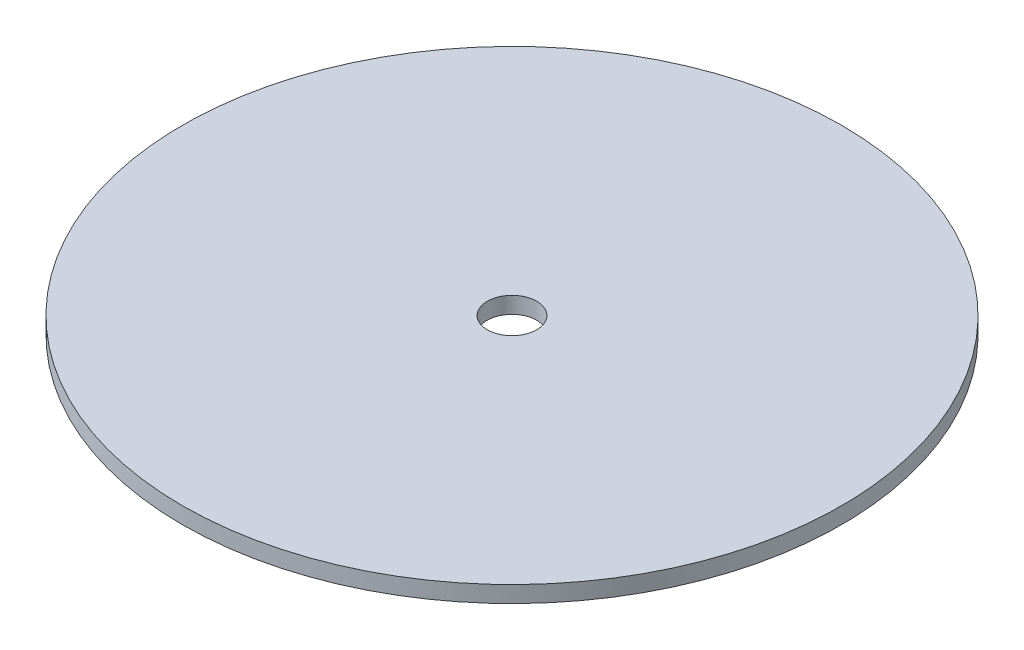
SolidWorks part; units mm, degrees
ref_plane "Płaszczyzna przednia" through (0, 0, 0) normal (0, 0, 1) x (1, 0, 0)
ref_plane "Płaszczyzna górna" through (0, 0, 0) normal (0, 1, 0) x (1, 0, 0)
ref_plane "Płaszczyzna prawa" through (0, 0, 0) normal (1, 0, 0) x (0, 0, -1)
sketch "Szkic1" plane through (0, 0, 0) normal (0, 1, 0) x (1, 0, 0)
  circle A0 centre (0, 0) radius 400
  circle A1 centre (0, 0) radius 30
  dimension "D1" = 60
  dimension "D2" = 800
extrude "Dodanie-wyciągnięcie1" add sketch "Szkic1" along normal blind 20
